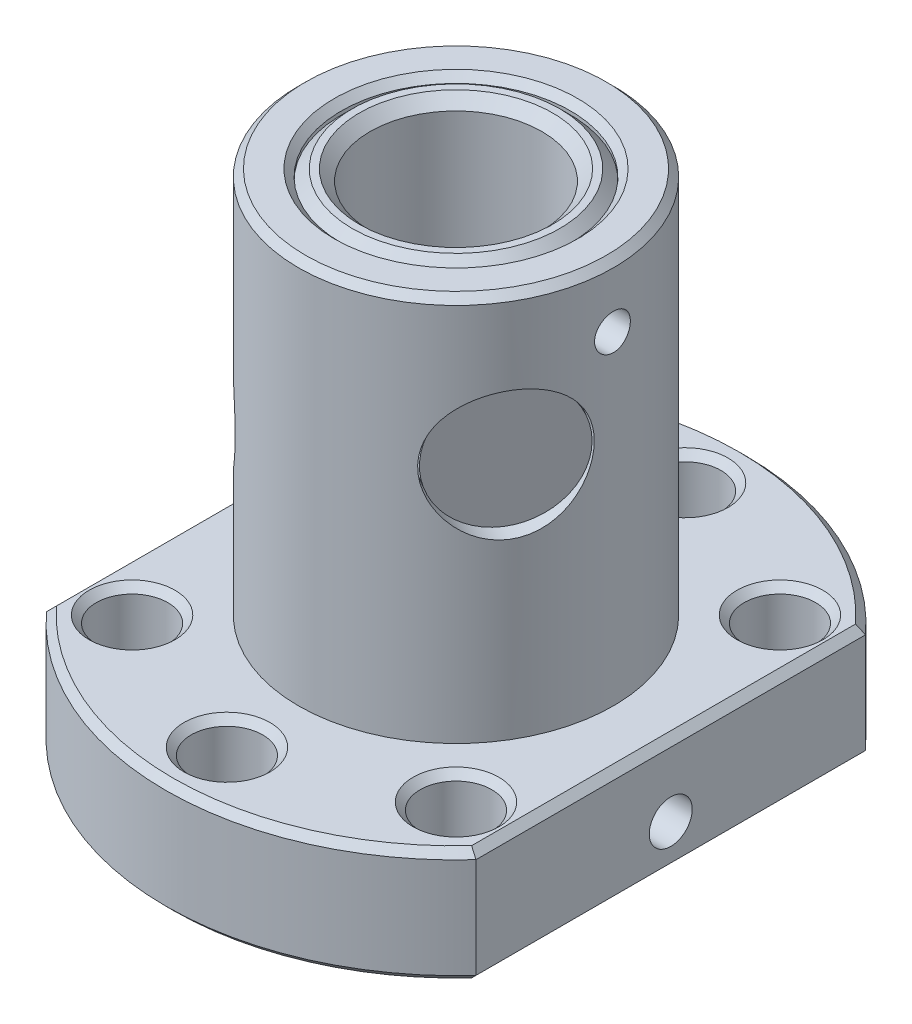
SolidWorks part; units mm, degrees
ref_plane "Front" through (0, 0, 0) normal (0, 0, 1) x (1, 0, 0)
ref_plane "Top" through (0, 0, 0) normal (0, 1, 0) x (1, 0, 0)
ref_plane "Right" through (0, 0, 0) normal (1, 0, 0) x (0, 0, -1)
sketch "Sketch1" plane through (0, 0, 0) normal (0, 1, 0) x (1, 0, 0)
  line L0 (0, 20.25) -> (0, -20.25) construction
  line L1 (-15, 0) -> (15, 0) construction
  line L2 (-15, 13.6038) -> (-15, -13.6038)
  line L3 (15, 13.6038) -> (15, -13.6038)
  arc A0 (-15, -13.6038) -> (15, -13.6038) centre (0, 0) ccw
  arc A1 (15, 13.6038) -> (-15, 13.6038) centre (0, 0) ccw
  dimension "D1" = 40.5
  dimension "D2" = 30
extrude "Boss-Extrude1" add sketch "Sketch1" along normal blind 8
sketch "Sketch2" plane through (0, 8, 0) normal (0, 1, 0) x (1, 0, 0)
  circle A0 centre (0, 0) radius 11
  dimension "D1" = 22
extrude "Boss-Extrude2" add sketch "Sketch2" along normal blind 27
hole_wizard "Ø16.0mm Dowel Hole1" positions "Sketch4" profile "Sketch5" hole size "Ø16.0" standard "ISO"
sketch "Sketch4" plane through (0, 0, 0) normal (0, -1, 0) x (-1, 0, 0)
  point P0 (0, 0)
sketch "Sketch5" plane through (0, 0, 0) normal (1, 0, 0) x (0, 0, -1)
  line L0 (0, 0) -> (0, 35)
  line L1 (0, 35) -> (8, 35)
  line L2 (8, 35) -> (8, 0)
  line L5 (8, 0) -> (0, 0)
  line L11 (0, -6.35) -> (0, 107.95) construction
  dimension "Thru Hole Dia." = 16
  dimension "Thru Hole Depth" = 35
hole_wizard "Ø5.0mm Dowel Hole1" positions "Sketch7" profile "Sketch6" hole size "Ø5.0" standard "ISO"
sketch "Sketch7" plane through (0, 0, 0) normal (0, -1, 0) x (-1, 0, 0)
  line L0 (0, -20.25) -> (0, 20.25) construction
  line L2 (15, 0) -> (-15, 0) construction
  line L3 (15, 13.6038) -> (15, -13.6038) construction
  line L4 (-15, -13.6038) -> (-15, 13.6038) construction
  line L6 (0, 0) -> (11.3137, -11.3137) construction
  arc A0 (-15, -13.6038) -> (15, -13.6038) centre (0, 0) ccw construction
  arc A1 (15, 13.6038) -> (-15, 13.6038) centre (0, 0) ccw construction
  point P0 (0, -16)
  point P2 (11.3137, -11.3137)
  point P30 (-11.3137, -11.3137)
  point P32 (-11.3137, 11.3137)
  point P33 (0, 16)
  point P34 (11.3137, 11.3137)
  dimension "D1" = 16
  dimension "D2" = 45
  dimension "D3" = 16
sketch "Sketch6" plane through (0, 0, 16) normal (1, 0, 0) x (0, 0, -1)
  line L0 (0, 0) -> (0, 8)
  line L1 (0, 8) -> (2.5, 8)
  line L2 (2.5, 8) -> (2.5, 0)
  line L5 (2.5, 0) -> (0, 0)
  line L11 (0, -6.35) -> (0, 107.95) construction
  dimension "Thru Hole Dia." = 5
  dimension "Thru Hole Depth" = 8
hole_wizard "Ø3.0mm Dowel Hole1" positions "Sketch9" profile "Sketch8" hole size "Ø3.0" standard "ISO"
sketch "Sketch9" plane through (15, 0, 0) normal (1, 0, 0) x (0, 0, -1)
  point P0 (0, 3)
  dimension "D1" = 3
sketch "Sketch8" plane through (15, 3, 0) normal (0, 1, 0) x (0, 0, -1)
  line L0 (0, 0) -> (0, 30)
  line L1 (0, 30) -> (1.5, 30)
  line L2 (1.5, 30) -> (1.5, 0)
  line L5 (1.5, 0) -> (0, 0)
  line L11 (0, -6.35) -> (0, 107.95) construction
  dimension "Thru Hole Dia." = 3
  dimension "Thru Hole Depth" = 30
hole_wizard "M5 Tapped Hole1" positions "3DSketch1" profile "Sketch10" tap size "M5" standard "ISO"
sketch3d "3DSketch1"
  line L1 (0, 0, 0) -> (0, 0, -16) construction
  line L2 (0, 8, -16) -> (0, 0, -16) construction
  line L4 (0, 0, 0) -> (7.7493, 0, -18.7086) construction
  arc A0 (15, 0, -13.6038) -> (-15, 0, -13.6038) centre (0, 0, 0) ccw construction
  point P17 (0, 20.25, 0)
  point P40 (7.7491, 5, -18.7087)
  dimension "D1" = 22.5
  dimension "D2" = 5
sketch "Sketch10" plane through (7.7491, 5, -18.7087) normal (0, 1, 0) x (-0.9239, 0, -0.3827)
  line L0 (0, 0) -> (0, 12.25)
  line L1 (0, 12.25) -> (2.1, 12.25)
  line L2 (2.1, 12.25) -> (2.1, 0)
  line L5 (2.1, 0) -> (0, 0)
  line L11 (0, -6.35) -> (0, 16.6804) construction
  dimension "Thru Tap Drill Dia." = 4.2
  dimension "Thru Tap Drill Depth" = 12.25
hole_wizard "Ø8.0mm Dowel Hole1" positions "3DSketch2" profile "Sketch16" hole size "Ø8.0" standard "ISO"
sketch3d "3DSketch2"
  point P10 (-9.6802, 19.8908, 5.2243)
  point P18 (9.4508, 24.6248, 5.6287)
  point P21 (1.1665, 15, -10.938)
  dimension "D1" = 7
sketch "Sketch16" plane through (-9.6802, 19.8908, 5.2243) normal (0, 1, 0) x (0.4749, 0, 0.88)
  line L0 (0, 0) -> (0, 3)
  line L1 (0, 3) -> (4.5, 3)
  line L2 (4.5, 3) -> (4.5, 0)
  line L5 (4.5, 0) -> (0, 0)
  line L11 (0, -6.35) -> (0, 107.95) construction
  dimension "Thru Hole Dia." = 9
  dimension "Thru Hole Depth" = 3
hole_wizard "M3 Tapped Hole1" positions "Sketch18" profile "Sketch19" tap size "M3" standard "ISO"
sketch "Sketch18" plane through (-15, 0, 0) normal (1, 0, 0) x (0, 0, -1)
  point P0 (0, 30.6226)
sketch "Sketch19" plane through (-15, 30.6226, 0) normal (0, 1, 0) x (0, 0, 1)
  line L0 (0, 0) -> (0, 30)
  line L1 (0, 30) -> (1.25, 30)
  line L2 (1.25, 30) -> (1.25, 0)
  line L5 (1.25, 0) -> (0, 0)
  line L11 (0, -6.35) -> (0, 107.95) construction
  dimension "Thru Tap Drill Dia." = 2.5
  dimension "Thru Tap Drill Depth" = 30
sketch "Sketch20" plane through (0, 0, 0) normal (0, -1, 0) x (1, 0, 0)
  circle A0 centre (0, 0) radius 8
  circle A1 centre (0, 0) radius 6
  dimension "D1" = 16
  dimension "D2" = 12
extrude "Boss-Extrude3" add sketch "Sketch20" against normal up to surface (35 mm away) separate body
chamfer "Chamfer1" distance 0.5 23 edges at (0, 35, 11) (0, 35, -8) (15, 8, 0) (0, 8, 20.25) (-15, 8, 0) (0, 8, -20.25) (-11.3137, 8, -8.8137) (0, 8, -13.5) (11.3137, 8, -8.8137) (11.3137, 8, 13.8137) (-11.3137, 8, 13.8137) (0, 8, 18.5) (-11.3137, 0, 8.8137) (11.3137, 0, 8.8137) (11.3137, 0, -13.8137) (0, 0, -18.5) (-11.3137, 0, -13.8137) (0, 0, -8) (-15, 0, 0) (0, 0, 20.25) (15, 0, 0) (0, 0, -20.25) (0, 0, 13.5)
chamfer "Chamfer2" distance 0.75 4 edges at (0, 35, 6) (0, 35, 8) (0, 0, -8) (0, 0, -6)
ref_plane "Plane1" through (0.8483, 0, -7.9549) normal (0.106, 0, -0.9944) x (-0.9944, 0, -0.106)
sketch "Sketch21" plane through (0.8483, 0, -7.9549) normal (0.106, 0, -0.9944) x (-0.9944, 0, -0.106)
  circle A0 centre (0, 15) radius 4.4
  dimension "D1" = 8.8
extrude "Boss-Extrude4" add sketch "Sketch21" along normal blind 2 separate body
ref_plane "Plane2" through (-7.0402, 0, 3.7995) normal (-0.88, 0, 0.4749) x (0.4749, 0, 0.88)
sketch "Sketch22" plane through (-7.0402, 0, 3.7995) normal (-0.88, 0, 0.4749) x (0.4749, 0, 0.88)
  circle A0 centre (0, 19.8908) radius 4.4
  dimension "D1" = 8.8
extrude "Boss-Extrude5" add sketch "Sketch22" along normal blind 2
ref_plane "Plane3" through (6.8733, 0, 4.0936) normal (0.8592, 0, 0.5117) x (0.5117, 0, -0.8592)
sketch "Sketch23" plane through (6.8733, 0, 4.0936) normal (0.8592, 0, 0.5117) x (0.5117, 0, -0.8592)
  circle A0 centre (0, 24.6248) radius 4.4
  dimension "D1" = 8.8
extrude "Boss-Extrude6" add sketch "Sketch23" along normal blind 2 separate body
